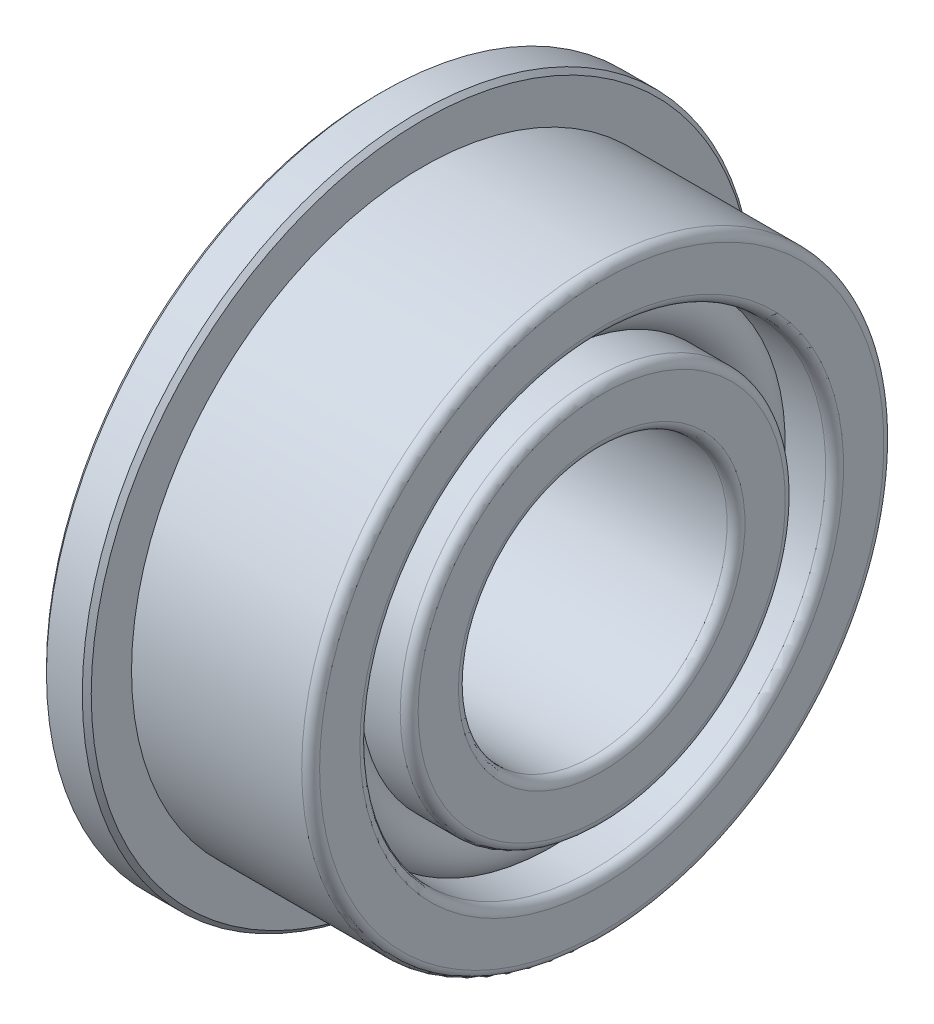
SolidWorks part; units mm, degrees
ref_plane "前视" through (0, 0, 0) normal (0, 0, 1) x (1, 0, 0)
ref_plane "上视" through (0, 0, 0) normal (0, 1, 0) x (1, 0, 0)
ref_plane "右视" through (0, 0, 0) normal (1, 0, 0) x (0, 0, -1)
sketch "草图1" plane through (0, 0, 0) normal (0, 0, 1) x (1, 0, 0)
  line L0 (0, 0) -> (5.81, 0) construction
  line L1 (2.5, 3.3596) -> (2.5, 6.1404) construction
  line L2 (0, 6.5) -> (3.8, 6.5)
  line L3 (0, 6.5) -> (0, 5.3916)
  line L4 (0.1916, 5.2) -> (2.1031, 5.2)
  line L5 (4, 6.3) -> (4, 5.4)
  line L6 (0, 3) -> (3.8, 3)
  line L7 (0, 3) -> (0, 4.1084)
  line L8 (0.1916, 4.3) -> (2.1031, 4.3)
  line L9 (4, 3.2) -> (4, 4.1)
  line L10 (2.8969, 5.2) -> (3.8, 5.2)
  line L11 (2.8969, 4.3) -> (3.8, 4.3)
  arc A0 (2.1031, 5.2) -> (2.1031, 4.3) centre (2.5, 4.75) ccw
  arc A1 (2.8969, 4.3) -> (2.8969, 5.2) centre (2.5, 4.75) ccw
  arc A3 (3.8, 6.5) -> (4, 6.3) centre (3.8, 6.3) cw
  arc A4 (3.8, 5.2) -> (4, 5.4) centre (3.8, 5.4) ccw
  arc A5 (3.8, 4.3) -> (4, 4.1) centre (3.8, 4.1) cw
  arc A6 (3.8, 3) -> (4, 3.2) centre (3.8, 3.2) ccw
  arc A8 (0, 4.1084) -> (0.1916, 4.3) centre (0.1916, 4.1084) cw
  arc A9 (0, 5.3916) -> (0.1916, 5.2) centre (0.1916, 5.3916) ccw
  point P23 (4, 6.5)
  point P30 (4, 3)
  point P36 (0, 4.3)
  point P39 (0, 5.2)
  dimension "D4" = 1.2
  dimension "D2" = 6
  dimension "D5" = 4
  dimension "D6" = 13
  dimension "D7" = 1.75
  dimension "D10" = 1.5
revolve "旋转1" add sketch "草图1" angle 360 about L0
sketch "草图2" plane through (0, 0, 0) normal (-1, 0, 0) x (0, 0, 1)
  circle A0 centre (0, 0) radius 7.5
  circle A1 centre (0, 0) radius 3
  dimension "D1" = 15
  dimension "D2" = 6
extrude "拉伸1" add sketch "草图2" along normal blind 1
chamfer "倒角1" distance 0.1 angle 45 3 edges at (0, 0, 7.5) (-1, 0, 7.5) (-1, 0, 3)
